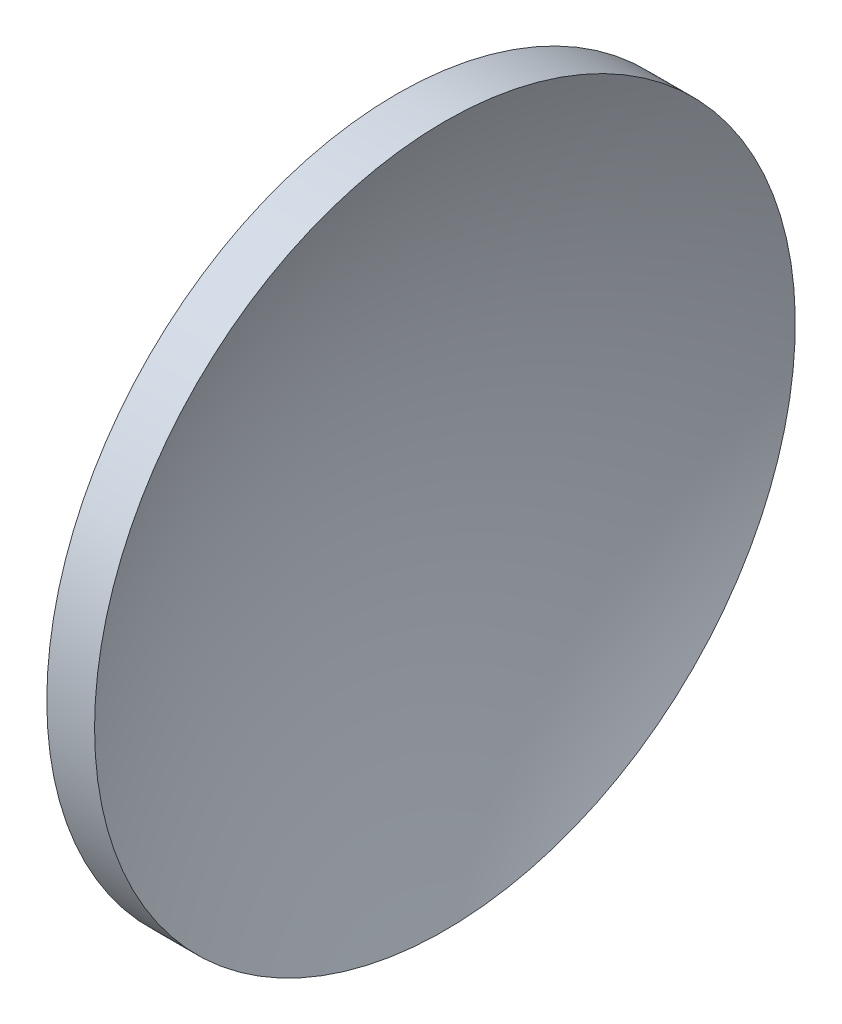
SolidWorks part; units mm, degrees
ref_plane "前基準面" through (0, 0, 0) normal (0, 0, 1) x (1, 0, 0)
ref_plane "上基準面" through (0, 0, 0) normal (0, 1, 0) x (1, 0, 0)
ref_plane "右基準面" through (0, 0, 0) normal (1, 0, 0) x (0, 0, -1)
sketch "草圖2" plane through (0, 0, 0) normal (0, 0, 1) x (1, 0, 0)
  line L0 (2.6731, 20.55) -> (5.4742, 20.55)
  line L1 (-2.5, 0) -> (0.1913, 0)
  spline S0 degree 4 poles (0.244, -2.0571) (0.2374, -1.9118) (0.2253, -1.7046) (0.2104, -1.2193) (0.1973, -0.8466) (0.1911, -0.1754) (0.1906, 0.0923) (0.1949, 0.6384) (0.203, 0.9814) (0.215, 1.4138) (0.231, 1.7961) (0.2511, 2.2066) (0.2751, 2.6012) (0.3101, 3.1037) (0.3601, 3.701) (0.4299, 4.3999) (0.5254, 5.195) (0.6364, 5.9892) (0.7627, 6.7804) (0.9043, 7.5695) (1.0608, 8.3554) (1.2322, 9.1385) (1.4179, 9.9179) (1.6181, 10.6944) (1.871, 11.6072) (2.1449, 12.5158) (2.4369, 13.4154) (2.7503, 14.3131) (3.0246, 15.061) (3.3899, 16.0038) (3.7631, 16.9152) (4.1765, 17.8587) (4.5353, 18.6424) (4.8218, 19.2402) (5.0326, 19.6782) (5.3737, 20.3551) (5.5109, 20.6235) (5.8726, 21.3142) (6.0533, 21.6462) (6.2691, 22.0424) (6.389, 22.2565) (6.456, 22.3764) (6.4903, 22.4377) knots 0 0 0 0 0 0.020186 0.040372 0.060308 0.080243 0.095883 0.111524 0.127164 0.142805 0.158445 0.174086 0.189726 0.205366 0.236647 0.267928 0.299209 0.33049 0.361771 0.393051 0.424332 0.455613 0.486894 0.518175 0.549456 0.603577 0.634858 0.666139 0.69742 0.728701 0.791262 0.822543 0.853824 0.869464 0.885105 0.916386 0.937289 0.958193 0.979096 0.989548 1 1 1 1 1 construction
  spline S1 degree 4 poles (0.1913, 0) (0.1913, 0.0838) (0.1919, 0.2551) (0.1949, 0.6384) (0.203, 0.9814) (0.215, 1.4138) (0.231, 1.7961) (0.2511, 2.2066) (0.2751, 2.6012) (0.3101, 3.1037) (0.3601, 3.701) (0.4299, 4.3999) (0.5254, 5.195) (0.6364, 5.9892) (0.7627, 6.7804) (0.9043, 7.5695) (1.0608, 8.3554) (1.2322, 9.1385) (1.4179, 9.9179) (1.6181, 10.6944) (1.871, 11.6072) (2.1449, 12.5158) (2.4369, 13.4154) (2.7503, 14.3131) (3.0246, 15.061) (3.3899, 16.0038) (3.7631, 16.9152) (4.1765, 17.8587) (4.5353, 18.6424) (4.8218, 19.2402) (5.0326, 19.6782) (5.2883, 20.1855) (5.3976, 20.401) (5.4742, 20.55) knots 0.080243 0.080243 0.080243 0.080243 0.080243 0.095883 0.111524 0.127164 0.142805 0.158445 0.174086 0.189726 0.205366 0.236647 0.267928 0.299209 0.33049 0.361771 0.393051 0.424332 0.455613 0.486894 0.518175 0.549456 0.603577 0.634858 0.666139 0.69742 0.728701 0.791262 0.822543 0.853824 0.869464 0.885105 0.916386 0.916386 0.916386 0.916386 0.916386
  spline S2 degree 4 poles (-2.4483, -2.0571) (-2.4548, -1.9117) (-2.4667, -1.7047) (-2.4812, -1.2192) (-2.4941, -0.8467) (-2.5002, -0.1754) (-2.5006, 0.092) (-2.4964, 0.6378) (-2.4886, 0.9806) (-2.4768, 1.4126) (-2.4611, 1.7945) (-2.4415, 2.2047) (-2.418, 2.599) (-2.3838, 3.1011) (-2.3349, 3.698) (-2.2667, 4.3965) (-2.1733, 5.1911) (-2.0647, 5.9849) (-1.9411, 6.7759) (-1.8026, 7.5648) (-1.6495, 8.3507) (-1.4817, 9.1339) (-1.2999, 9.9135) (-1.1038, 10.6903) (-0.8572, 11.5997) (-0.5901, 12.5053) (-0.3054, 13.402) (0.0004, 14.2974) (0.2688, 15.046) (0.5564, 15.8038) (0.8442, 16.5339) (1.2409, 17.4854) (1.5786, 18.2623) (1.9489, 19.061) (2.2449, 19.6864) (2.573, 20.3516) (2.7099, 20.6253) (3.0632, 21.314) (3.2428, 21.6512) (3.4532, 22.0457) (3.5718, 22.262) (3.6375, 22.382) (3.6711, 22.4433) knots 0 0 0 0 0 0.020216 0.040432 0.060397 0.080362 0.096012 0.111662 0.127313 0.142963 0.158613 0.174263 0.189914 0.205564 0.236865 0.268165 0.299466 0.330767 0.362067 0.393368 0.424669 0.455969 0.48727 0.518571 0.549871 0.60339 0.634691 0.665991 0.697292 0.728593 0.759893 0.791194 0.853795 0.869446 0.885096 0.916397 0.937297 0.958198 0.979099 0.98955 1 1 1 1 1 construction
  spline S3 degree 4 poles (-2.5, 0) (-2.5, 0.0837) (-2.4993, 0.2549) (-2.4964, 0.6378) (-2.4886, 0.9806) (-2.4768, 1.4126) (-2.4611, 1.7945) (-2.4415, 2.2047) (-2.418, 2.599) (-2.3838, 3.1011) (-2.3349, 3.698) (-2.2667, 4.3965) (-2.1733, 5.1911) (-2.0647, 5.9849) (-1.9411, 6.7759) (-1.8026, 7.5648) (-1.6495, 8.3507) (-1.4817, 9.1339) (-1.2999, 9.9135) (-1.1038, 10.6903) (-0.8572, 11.5997) (-0.5901, 12.5053) (-0.3054, 13.402) (0.0004, 14.2974) (0.2688, 15.046) (0.5564, 15.8038) (0.8442, 16.5339) (1.2409, 17.4854) (1.5786, 18.2623) (1.9489, 19.061) (2.2449, 19.6864) (2.4909, 20.1851) (2.5978, 20.4005) (2.6731, 20.55) knots 0.080362 0.080362 0.080362 0.080362 0.080362 0.096012 0.111662 0.127313 0.142963 0.158613 0.174263 0.189914 0.205564 0.236865 0.268165 0.299466 0.330767 0.362067 0.393368 0.424669 0.455969 0.48727 0.518571 0.549871 0.60339 0.634691 0.665991 0.697292 0.728593 0.759893 0.791194 0.853795 0.869446 0.885096 0.916397 0.916397 0.916397 0.916397 0.916397
revolve "旋轉2" add sketch "草圖2" angle 360 about L1
